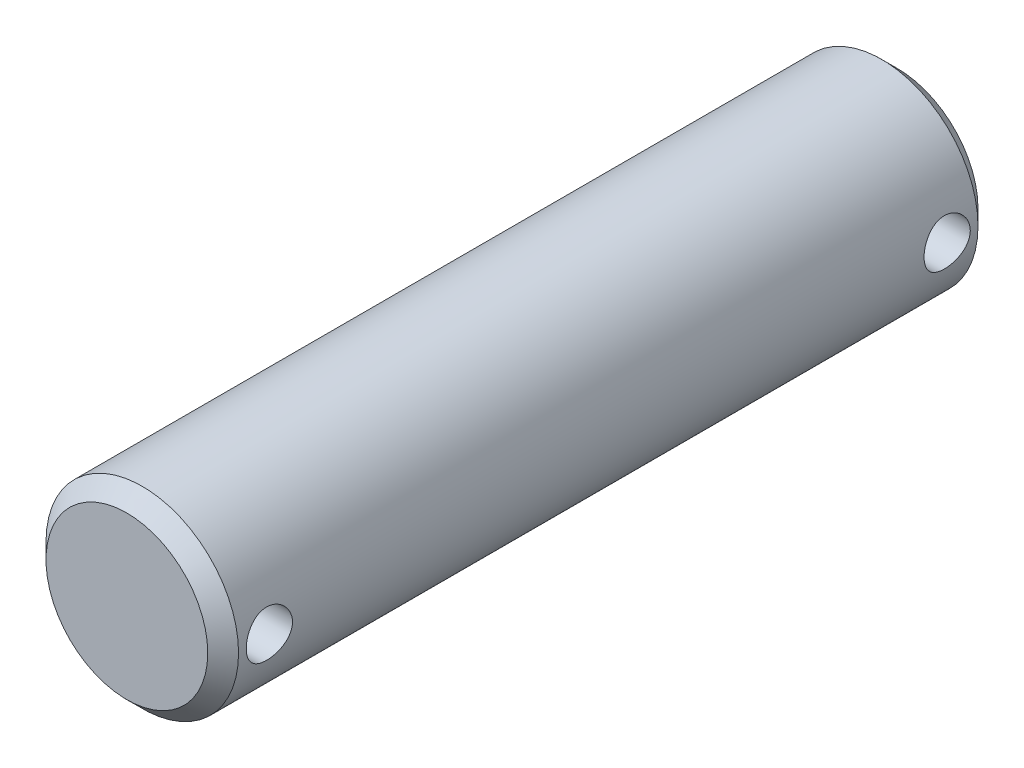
SolidWorks part; units mm, degrees
ref_plane "Face" through (0, 0, 0) normal (0, 0, 1) x (1, 0, 0)
ref_plane "Dessus" through (0, 0, 0) normal (0, 1, 0) x (1, 0, 0)
ref_plane "Droite" through (0, 0, 0) normal (1, 0, 0) x (0, 0, -1)
sketch "Esquisse1" plane through (0, 0, 0) normal (0, 0, 1) x (1, 0, 0)
  circle A0 centre (0, 0) radius 12.5
  dimension "D1" = 25
extrude "Base-Extrusion" add sketch "Esquisse1" along normal blind 100
chamfer "Chanfrein1" distance 2 angle 45
sketch "Esquisse2" plane through (0, 0, 0) normal (1, 0, 0) x (0, 0, -1)
  line L0 (-98, 0) -> (-2, 0) construction
  line L1 (0, -10.5) -> (0, 10.5) construction
  line L2 (-100, 10.5) -> (-100, -10.5) construction
  circle A0 centre (-6, 0) radius 3
  circle A1 centre (-94, 0) radius 3
  dimension "D1" = 6
  dimension "D2" = 6
  dimension "D3" = 6
extrude "Enlèv. mat.-Extru.1" cut sketch "Esquisse2" against normal mid plane 28
